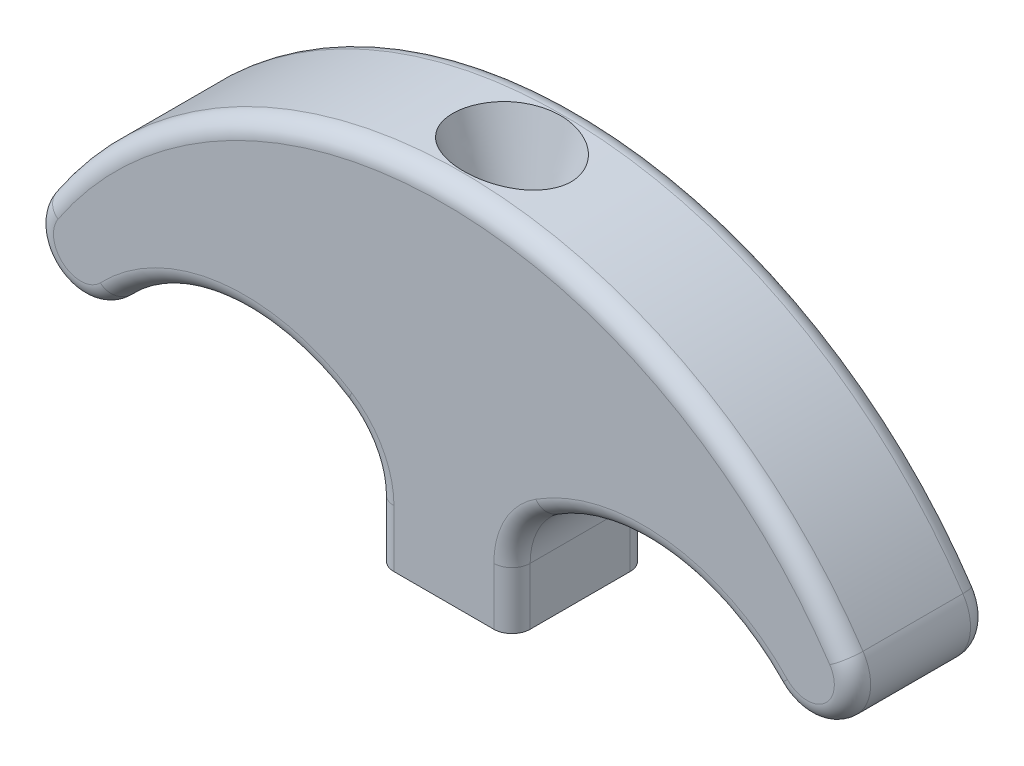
SolidWorks part; units mm, degrees
ref_plane "Front Plane" through (0, 0, 0) normal (0, 0, 1) x (1, 0, 0)
ref_plane "Top Plane" through (0, 0, 0) normal (0, 1, 0) x (1, 0, 0)
ref_plane "Right Plane" through (0, 0, 0) normal (1, 0, 0) x (0, 0, -1)
sketch "Sketch1" plane through (0, 0, 0) normal (0, 0, 1) x (1, 0, 0)
  line L0 (0, 0) -> (0, 30.5677) construction
  line L1 (-4.7625, 0) -> (4.7625, 0)
  line L2 (4.7625, 0) -> (4.7625, 6.35)
  line L3 (-4.7625, 0) -> (-4.7625, 6.35)
  arc A0 (23.1069, 6.35) -> (4.7625, 6.35) centre (13.9347, -2.4341) ccw
  arc A1 (23.1069, 6.35) -> (28.0407, 10.3088) centre (25.4, 8.546) ccw
  arc A2 (28.0407, 10.3088) -> (-28.0407, 10.3088) centre (0, -8.409) ccw
  arc A3 (-23.1069, 6.35) -> (-28.0407, 10.3088) centre (-25.4, 8.546) cw
  arc A4 (-23.1069, 6.35) -> (-4.7625, 6.35) centre (-13.9347, -2.4341) cw
  dimension "D2" = 3.175
  dimension "D6" = 12.7
  dimension "D5" = 8.409
  dimension "D1" = 25.4
  dimension "D3" = 9.525
  dimension "D4" = 6.35
extrude "Boss-Extrude1" add sketch "Sketch1" along normal blind 9.525
fillet "Fillet1" radius 5.08 2 edges at (-4.7625, 6.35, 4.7625) (4.7625, 6.35, 4.7625)
sketch "Sketch2" plane through (0, 0, 0) normal (0, -1, 0) x (1, 0, 0)
  line L0 (-4.7625, 9.525) -> (4.7625, 9.525) construction
  line L1 (-4.7625, 9.525) -> (-4.7625, 0) construction
  circle A0 centre (0, 4.7625) radius 1.905
  dimension "D1" = 3.81
  dimension "D2" = 4.7625
  dimension "D3" = 4.7625
extrude "Cut-Extrude1" cut sketch "Sketch2" against normal through all
fillet "Fillet2" radius 1.27 18 edges at (4.7625, 1.9969, 9.525) (5.3891, 6.4379, 9.525) (15.4556, 10.1745, 9.525) (27.387, 6.0696, 9.525) (-4.7625, 1.9969, 9.525) (-5.3891, 6.4379, 9.525) (-15.4556, 10.1745, 9.525) (-27.387, 6.0696, 9.525) (-4.7625, 1.9969, 0) (-5.3891, 6.4379, 0) (-15.4556, 10.1745, 0) (-27.387, 6.0696, 0) (0, 25.305, 0) (27.387, 6.0696, 0) (15.4556, 10.1745, 0) (4.7625, 1.9969, 0) (0, 25.305, 9.525) (5.3891, 6.4379, 0)
chamfer "Chamfer1" distance 6.35 angle 20 1 edges at (-0.4348, 25.3022, 6.6172)
